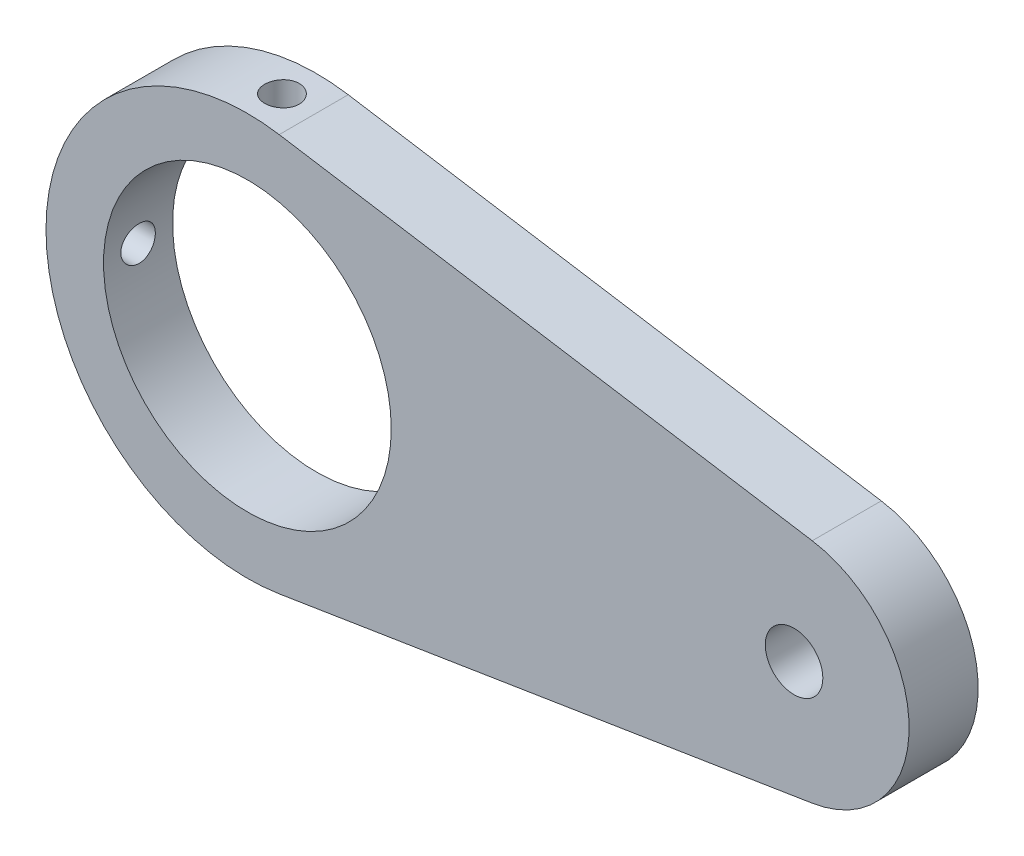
SolidWorks part; units mm, degrees
ref_plane "前视基准面" through (0, 0, 0) normal (0, 0, 1) x (1, 0, 0)
ref_plane "上视基准面" through (0, 0, 0) normal (0, 1, 0) x (1, 0, 0)
ref_plane "右视基准面" through (0, 0, 0) normal (1, 0, 0) x (0, 0, -1)
sketch "草图1" plane through (0, 0, 0) normal (0, 0, 1) x (1, 0, 0)
  line L0 (0, 0) -> (95, 0) construction
  line L1 (5.5263, 34.561) -> (98.1579, 19.7491)
  line L2 (5.5263, -34.561) -> (98.1579, -19.7491)
  circle A0 centre (0, 0) radius 25
  arc A1 (5.5263, 34.561) -> (5.5263, -34.561) centre (0, 0) ccw
  arc A2 (98.1579, -19.7491) -> (98.1579, 19.7491) centre (95, 0) ccw
  circle A3 centre (95, 0) radius 5
extrude "凸台-拉伸1" add sketch "草图1" along normal blind 12
ref_plane "基准面1" through (0, 35, 0) normal (0, 1, 0) x (1, 0, 0)
sketch "草图2" plane through (0, 35, 0) normal (0, 1, 0) x (1, 0, 0)
  line L0 (0, 0) -> (0, -12) construction
  circle A0 centre (0, -6) radius 3
extrude "切除-拉伸1" cut sketch "草图2" against normal blind 12
ref_plane "基准面2" through (-35, 0, 0) normal (1, 0, 0) x (0, 0, -1)
sketch "草图3" plane through (-35, 0, 0) normal (1, 0, 0) x (0, 0, -1)
  line L0 (0, 0) -> (-12, 0) construction
  circle A0 centre (-6, 0) radius 3
extrude "切除-拉伸2" cut sketch "草图3" along normal blind 16
